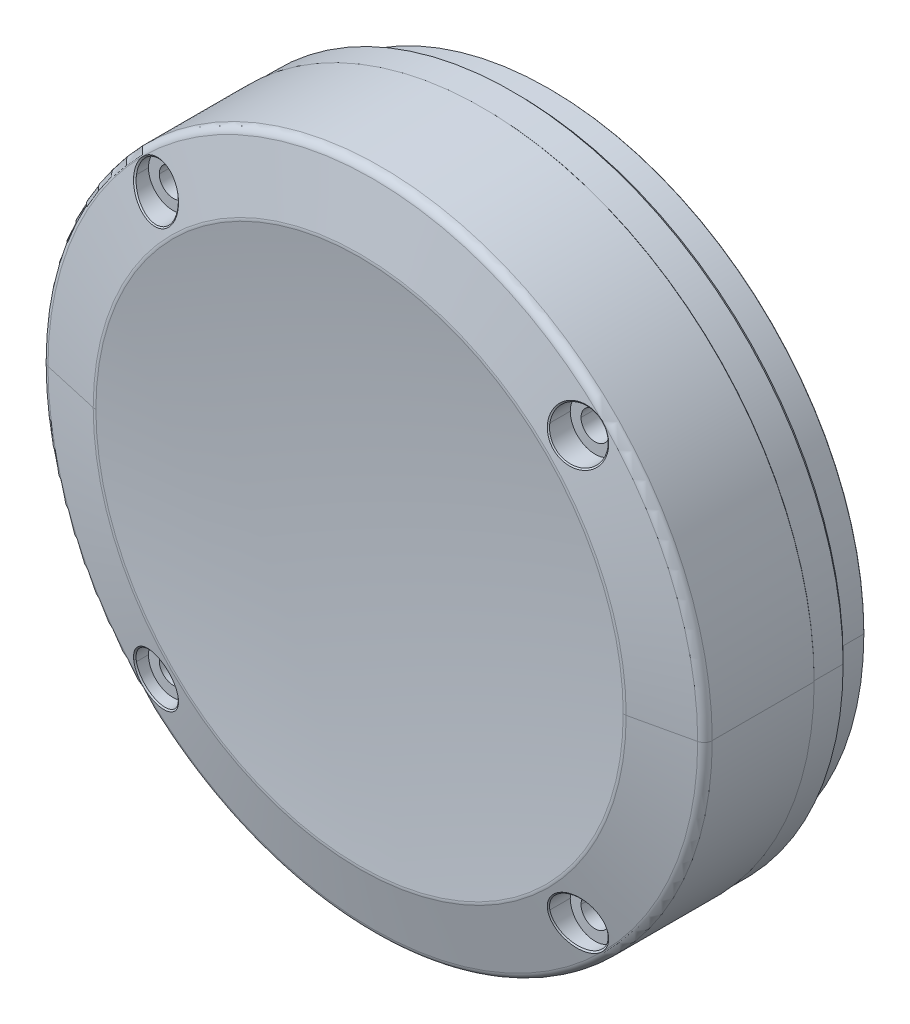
SolidWorks part; units mm, degrees
ref_plane "前视基准面" through (0, 0, 0) normal (0, 0, 1) x (1, 0, 0)
ref_plane "上视基准面" through (0, 0, 0) normal (0, 1, 0) x (1, 0, 0)
ref_plane "右视基准面" through (0, 0, 0) normal (1, 0, 0) x (0, 0, -1)
imported_body "8.0.00.8012656.STEP"
ref_plane "基准面2" through (0, 0, 25) normal (0, 0, 1) x (1, 0, 0)
sketch "草图2" plane through (0, 0, 25) normal (0, 0, 1) x (1, 0, 0)
  line L1 (-27.6977, 12.9337) -> (27.6977, 12.9337)
  line L2 (-27.6977, 12.9337) -> (-27.6977, -10.4934)
  line L3 (-27.6977, -10.4934) -> (27.6977, -10.4934)
  line L4 (27.6977, 12.9337) -> (27.6977, -10.4934)
extrude "切除-拉伸1" cut sketch "草图2" against normal up to surface (2.1755 mm away)
